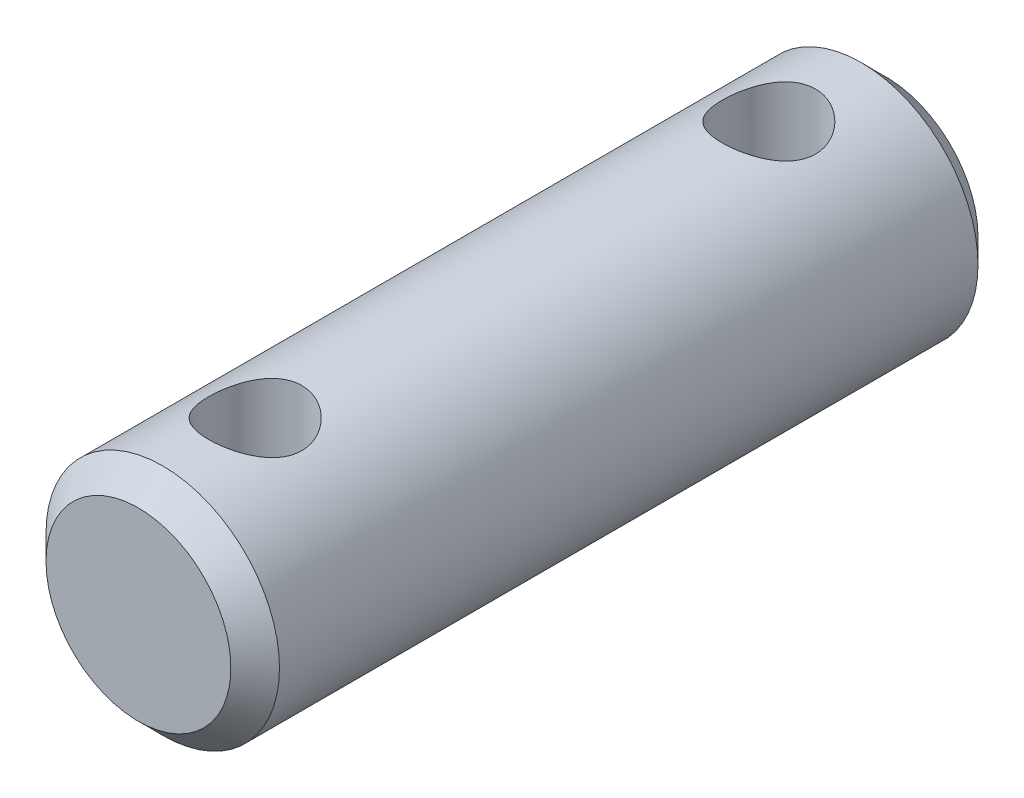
SolidWorks part; units mm, degrees
ref_plane "Front Plane" through (0, 0, 0) normal (0, 0, 1) x (1, 0, 0)
ref_plane "Top Plane" through (0, 0, 0) normal (0, 1, 0) x (1, 0, 0)
ref_plane "Right Plane" through (0, 0, 0) normal (1, 0, 0) x (0, 0, -1)
sketch "Sketch1" plane through (0, 0, 0) normal (0, 0, 1) x (1, 0, 0)
  circle A0 centre (0, 0) radius 3.9688
  dimension "D1" = 7.9375
extrude "Extrude1" add sketch "Sketch1" along normal mid plane 25.4
chamfer "Chamfer1" distance 0.8255 angle 45 2 edges at (3.9688, 0, -12.7) (3.9688, 0, 12.7)
sketch "Sketch2" plane through (0, 0, 0) normal (0, 1, 0) x (1, 0, 0)
  line L0 (0, 0) -> (10.3682, 0) construction
  circle A0 centre (0, 8.7312) radius 1.5875
  circle A1 centre (0, -8.7312) radius 1.5875
  dimension "D1" = 3.175
  dimension "D2" = 17.4625
extrude "Cut-Extrude1" cut sketch "Sketch2" against normal through all and the other way through all
